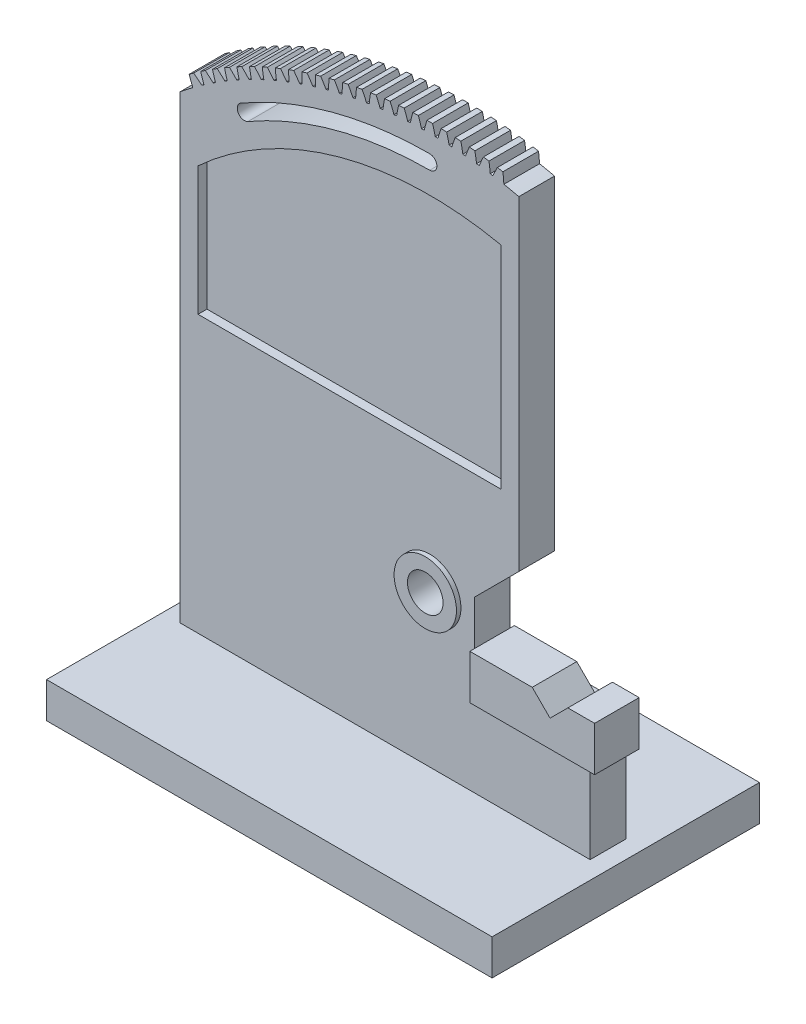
SolidWorks part; units mm, degrees
ref_plane "Front Plane" through (0, 0, 0) normal (0, 0, 1) x (1, 0, 0)
ref_plane "Top Plane" through (0, 0, 0) normal (0, 1, 0) x (1, 0, 0)
ref_plane "Right Plane" through (0, 0, 0) normal (1, 0, 0) x (0, 0, -1)
sketch "Sketch1" plane through (0, 0, 0) normal (0, 0, 1) x (1, 0, 0)
  line L0 (-278.371, 0) -> (13640.1788, 0) construction
  line L1 (0, -278.371) -> (0, 13640.1788) construction
  line L3 (-125, 10) -> (125, 10)
  line L4 (-125, 10) -> (-125, -10)
  line L5 (-125, -10) -> (125, -10)
  line L6 (125, 10) -> (125, -10)
  line L7 (-125, 10) -> (125, -10) construction
  line L8 (-125, -10) -> (125, 10) construction
  point P4 (0, 0)
  dimension "D1" = 20
  dimension "D2" = 250
extrude "Boss-Extrude1" add sketch "Sketch1" along normal mid plane 150
sketch "Sketch2" plane through (0, 0, 0) normal (0, 0, 1) x (1, 0, 0)
  line L0 (-1000, 0) -> (49000, 0) construction
  line L1 (0, -1000) -> (0, 49000) construction
  line L2 (0, 10) -> (-115, 10)
  line L3 (125, 10) -> (-125, 10) construction
  line L4 (-115, 10) -> (-115, 268.1294)
  line L5 (0, 10) -> (115, 10)
  line L6 (115, 10) -> (115, 65)
  line L7 (115, 65) -> (50, 65)
  line L8 (50, 65) -> (50, 105)
  line L9 (50, 105) -> (75, 130)
  line L10 (75, 130) -> (75, 312.1678)
  line L11 (25, -904) -> (25, 49096) construction
  line L20 (-79, 276.1333) -> (25, 96) construction
  arc A0 (0, -124.4621) -> (25, -125.875) centre (25, 96) ccw
  arc A1 (75, 312.1678) -> (-115, 268.1294) centre (25, 96) ccw
  arc A103 (-79, 276.1333) -> (25, 304) centre (25, 96) cw construction
  arc A104 (25, 308) -> (-81, 279.5974) centre (25, 96) ccw
  arc A105 (25, 300) -> (-77, 272.6692) centre (25, 96) ccw
  arc A106 (25, 300) -> (25, 308) centre (25, 304) ccw
  arc A107 (-81, 279.5974) -> (-77, 272.6692) centre (-79, 276.1333) ccw
  point P17 (25, 96)
  point P66 (25, 96)
  point P181 (25, 96)
  point P183 (-28.8344, 296.9126)
  dimension "D8" = 443.75
  dimension "D11" = 30
  dimension "D12" = 208
  dimension "D13" = 8
  dimension "D1" = 115
  dimension "D2" = 230
  dimension "D3" = 55
  dimension "D4" = 40
  dimension "D5" = 25
  dimension "D6" = 65
  dimension "D7" = 190
  dimension "D9" = 86
  dimension "D10" = 140
extrude "Boss-Extrude2" add sketch "Sketch2" along normal mid plane 20 contours L10 A1 L4 L2 L5 L6 L7 L8 L9 A107 A104 A106 A105
sketch "Sketch4" plane through (0, 0, 0) normal (0, 0, 1) x (1, 0, 0)
  line L0 (50, 55) -> (50, 80)
  line L1 (-125, -10) -> (125, -10) construction
  line L2 (50, 80) -> (85, 80)
  line L3 (85, 80) -> (95, 70)
  line L4 (95, 70) -> (105, 80)
  line L5 (105, 80) -> (120, 80)
  line L6 (120, 80) -> (120, 55)
  line L7 (120, 55) -> (50, 55)
  line L9 (95, 70) -> (95, 90.7649) construction
  line L10 (50, 65) -> (50, 105) construction
  circle A0 centre (25, 96) radius 17.5
  circle A1 centre (25, 96) radius 10
  arc A3 (75, 312.1678) -> (-115, 268.1294) centre (25, 96) ccw construction
  dimension "D1" = 35
  dimension "D2" = 20
  dimension "D3" = 70
  dimension "D4" = 25
  dimension "D5" = 65
  dimension "D6" = 10
  dimension "D7" = 35
  dimension "D8" = 15
extrude "Boss-Extrude3" add sketch "Sketch4" along normal mid plane 25
sketch "Sketch5" plane through (0, 0, 10) normal (0, 0, 1) x (1, 0, 0)
  circle A0 centre (25, 96) radius 10
  dimension "D1" = 20
extrude "Cut-Extrude1" cut sketch "Sketch5" against normal mid plane 120
sketch "Sketch6" plane through (0, 0, 10) normal (0, 0, 1) x (1, 0, 0)
  line L2 (-105, 10) -> (-105, 268.1294)
  line L3 (-105, 165) -> (-105, 237.1241)
  line L4 (-105, 165) -> (65, 165)
  line L5 (65, 130) -> (65, 312.1678)
  line L6 (65, 165) -> (65, 283.6593)
  line L7 (125, 10) -> (-125, 10) construction
  arc A2 (68.2394, 282.9395) -> (-96.0704, 244.8555) centre (25, 96) ccw
  arc A3 (65, 283.6593) -> (-105, 237.1241) centre (25, 96) ccw
  dimension "D4" = 155
  dimension "D1" = 30
  dimension "D2" = 10
  dimension "D3" = 10
extrude "Cut-Extrude2" cut sketch "Sketch6" against normal blind 5
mirror "Mirror1" about plane through (0, 0, 0) normal (0, 0, 1) of "Cut-Extrude2"
sketch "Sketch7" plane through (0, 0, 10) normal (0, 0, 1) x (1, 0, 0)
  line L0 (25, 96) -> (25, 339.4559) construction
  arc A0 (75, 312.1678) -> (-115, 268.1294) centre (25, 96) ccw construction
  arc A1 (26.5635, 323.4946) -> (23.4365, 323.4946) centre (25, 96) ccw
  circle A3 centre (25, 96) radius 217.8332 construction
  arc A4 (28.115, 317.8531) -> (26.5635, 323.4946) centre (-59.393, 296.8211) ccw
  arc A5 (23.4365, 323.4946) -> (21.885, 317.8531) centre (109.393, 296.8211) ccw
  arc A6 (28.115, 317.8531) -> (21.885, 317.8531) centre (25, 96) ccw
  dimension "D2" = 455
  dimension "D6" = 435.6664
  dimension "D7" = 90
  dimension "D8" = 6.23
  dimension "D4" = 6.23
extrude "Boss-Extrude4" add sketch "Sketch7" against normal blind 20 contours A5 A6 A4 A1
pattern_circular "CirPattern1" count 6 every 2 about axis through (25, 96, 0) along (0, 0, 1) of "Boss-Extrude4"
pattern_circular "CirPattern2" count 19 every 2 about axis through (25, 96, 0) along (0, 0, 1) of "Boss-Extrude4"
